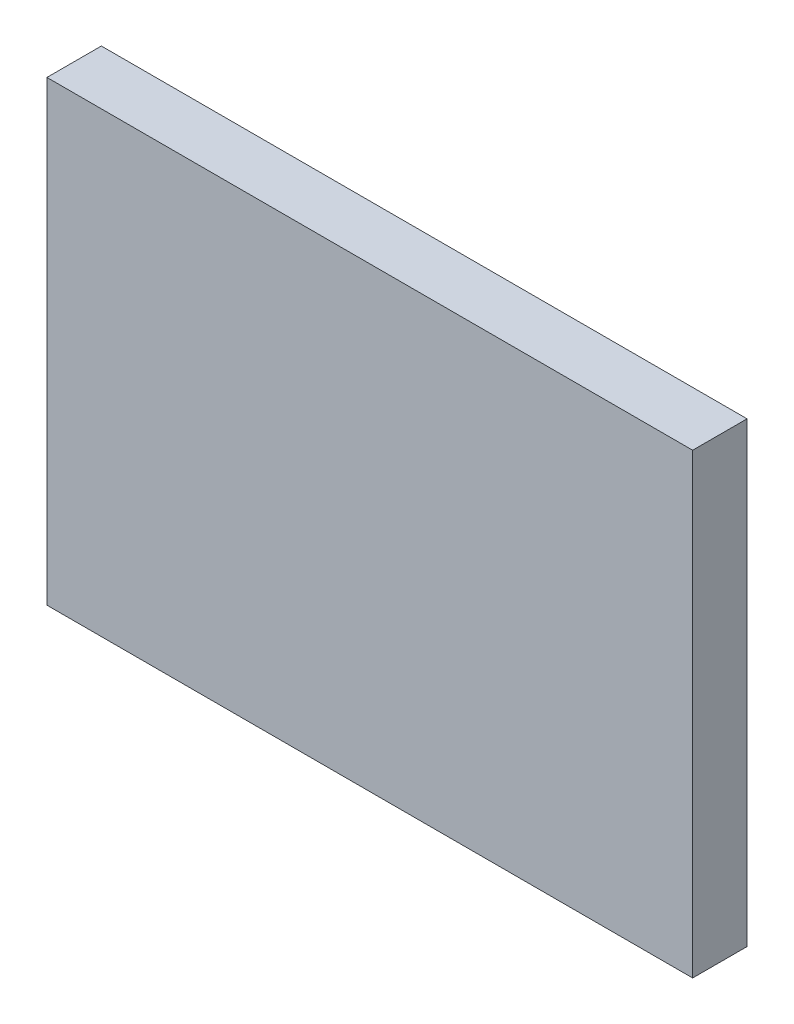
SolidWorks part; units mm, degrees
ref_plane "Front Plane" through (0, 0, 0) normal (0, 0, 1) x (1, 0, 0)
ref_plane "Top Plane" through (0, 0, 0) normal (0, 1, 0) x (1, 0, 0)
ref_plane "Right Plane" through (0, 0, 0) normal (1, 0, 0) x (0, 0, -1)
sketch "Sketch1" plane through (0, 0, 0) normal (0, 0, 1) x (1, 0, 0)
  line L1 (-17.8, 12.6) -> (17.8, 12.6)
  line L2 (-17.8, 12.6) -> (-17.8, -12.6)
  line L3 (-17.8, -12.6) -> (17.8, -12.6)
  line L4 (17.8, 12.6) -> (17.8, -12.6)
  line L5 (-17.8, 12.6) -> (17.8, -12.6) construction
  line L6 (-17.8, -12.6) -> (17.8, 12.6) construction
  point P0 (0, 0)
  dimension "D1" = 25.2
  dimension "D2" = 35.6
extrude "Boss-Extrude1" add sketch "Sketch1" along normal blind 3
